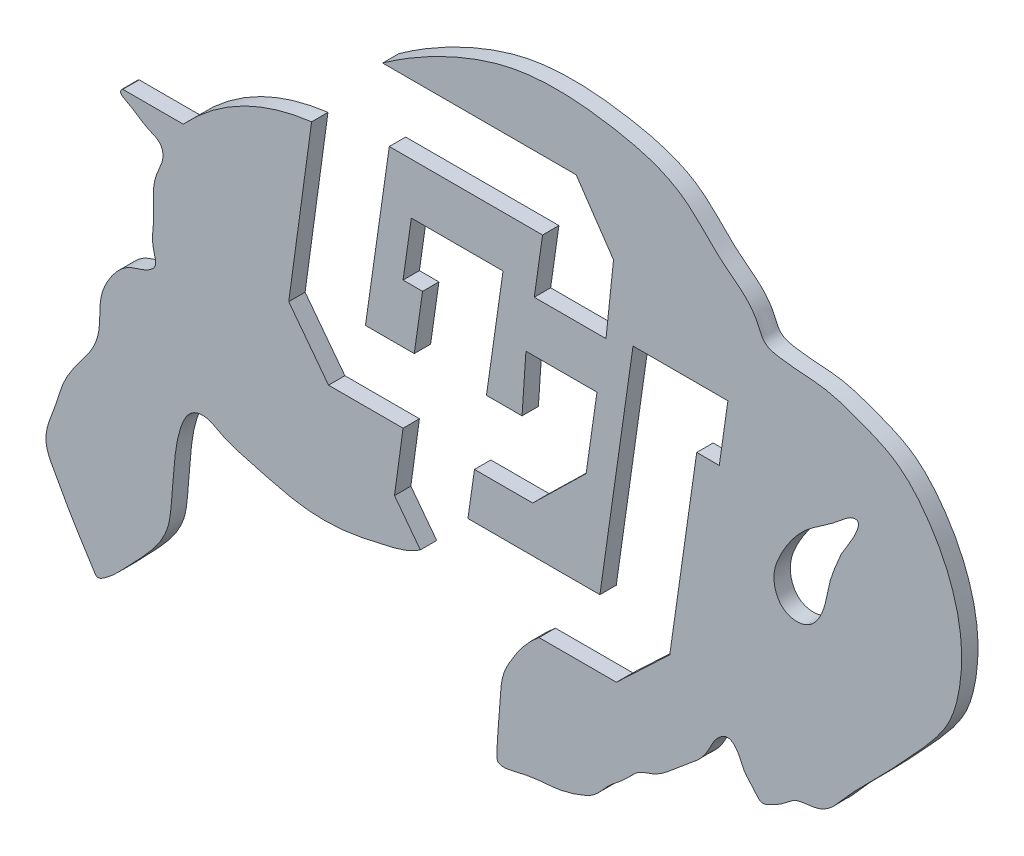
SolidWorks part; units mm, degrees
ref_plane "Front Plane" through (0, 0, 0) normal (0, 0, 1) x (1, 0, 0)
ref_plane "Top Plane" through (0, 0, 0) normal (0, 1, 0) x (1, 0, 0)
ref_plane "Right Plane" through (0, 0, 0) normal (1, 0, 0) x (0, 0, -1)
sketch "Sketch1" plane through (0, 0, 0) normal (0, 0, 1) x (1, 0, 0)
  line L0 (-34.6272, 39.8486) -> (140.0394, 39.8486) construction
sketch "Sketch2" plane through (0, 0, 0) normal (0, 0, 1) x (1, 0, 0)
  line L0 (-31.548, 27.0409) -> (-35.1224, 0.9367) construction
  line L1 (-35.1224, 0.9367) -> (-29.0428, -7.0721) construction
  line L2 (-29.0428, -7.0721) -> (-17.3586, -7.0721) construction
  line L3 (-17.3586, -7.0721) -> (-18.7082, -16.9287) construction
  line L4 (-18.7082, -16.9287) -> (-14.6259, -22.3064) construction
  line L5 (-19.8556, 29.723) -> (-23.607, 3.4631) construction
  line L6 (-23.607, 3.4631) -> (-15.6713, 3.4631) construction
  line L7 (-15.6713, 3.4631) -> (-14.3323, 12.8359) construction
  line L8 (-14.3323, 12.8359) -> (-17.3586, 12.8359) construction
  line L9 (-17.3586, 12.8359) -> (-16.1265, 21.4607) construction
  line L10 (-16.1265, 21.4607) -> (-2.2528, 21.4607) construction
  line L11 (-2.2528, 21.4607) -> (-4.8247, 3.457) construction
  line L12 (-4.8247, 3.457) -> (1.068, 3.457) construction
  line L13 (1.068, 3.457) -> (1.6717, 12.4589) construction
  line L14 (1.6717, 12.4589) -> (12.3273, 12.4589) construction
  line L15 (12.3273, 12.4589) -> (10.6812, 0.9367) construction
  line L16 (10.6812, 0.9367) -> (2.4844, -7.0721) construction
  line L17 (2.4844, -7.0721) -> (-6.6361, -7.0721) construction
  line L18 (-6.6361, -7.0721) -> (-7.7026, -14.5377) construction
  line L19 (-7.7026, -14.5377) -> (13.14, -14.5377) construction
  line L20 (13.14, -14.5377) -> (18.2826, 21.4607) construction
  line L21 (18.2826, 21.4607) -> (32.6451, 21.4607) construction
  line L22 (32.6451, 21.4607) -> (31.3591, 12.4589) construction
  line L23 (31.3591, 12.4589) -> (27.8591, 12.4589) construction
  line L24 (27.8591, 12.4589) -> (23.6609, -16.9287) construction
  line L25 (23.6609, -16.9287) -> (15.4789, -24.6644) construction
  line L26 (15.4789, -24.6644) -> (3.4788, -24.6644) construction
  line L27 (-51.7651, 16.7311) -> (-61.0758, 16.7311) construction
  line L28 (-19.8556, 29.723) -> (4.2918, 29.723) construction
  line L29 (4.2918, 29.723) -> (3.0042, 20.7097) construction
  line L30 (3.0042, 20.7097) -> (13.7738, 20.7097) construction
  line L31 (13.7738, 20.7097) -> (14.9162, 31.6686) construction
  line L32 (14.9162, 31.6686) -> (9.2041, 40.0653) construction
  line L33 (9.2041, 40.0653) -> (-21.2981, 40.0653) construction
  line L34 (-51.6877, 16.5533) -> (-61.058, 16.5533)
  line L35 (-18.8944, -16.9775) -> (-14.8782, -22.268)
  line L36 (-17.5624, -7.2499) -> (-18.8944, -16.9775)
  line L37 (-29.131, -7.2499) -> (-17.5624, -7.2499)
  line L38 (-35.3086, 0.8878) -> (-29.131, -7.2499)
  line L39 (-31.7554, 26.8365) -> (-35.3086, 0.8878)
  line L40 (-6.4818, -7.2499) -> (-7.4976, -14.3599)
  line L41 (-7.4976, -14.3599) -> (12.9858, -14.3599)
  line L42 (12.9858, -14.3599) -> (18.1284, 21.6385)
  line L43 (18.1284, 21.6385) -> (32.8501, 21.6385)
  line L44 (32.8501, 21.6385) -> (31.5133, 12.2811)
  line L45 (31.5133, 12.2811) -> (28.0133, 12.2811)
  line L46 (28.0133, 12.2811) -> (23.8281, -17.0152)
  line L47 (23.8281, -17.0152) -> (15.5497, -24.8422)
  line L48 (15.5497, -24.8422) -> (3.5399, -24.8422)
  line L49 (9.2982, 40.2431) -> (-20.744, 40.2431)
  line L50 (15.0998, 31.7149) -> (9.2982, 40.2431)
  line L51 (13.934, 20.5319) -> (15.0998, 31.7149)
  line L52 (2.7992, 20.5319) -> (13.934, 20.5319)
  line L53 (4.0868, 29.5452) -> (2.7992, 20.5319)
  line L54 (-19.7014, 29.5452) -> (4.0868, 29.5452)
  line L55 (-19.7014, 29.5452) -> (-23.402, 3.6409)
  line L56 (-23.402, 3.6409) -> (-15.8255, 3.6409)
  line L57 (-15.8255, 3.6409) -> (-14.5373, 12.6581)
  line L58 (-14.5373, 12.6581) -> (-17.5636, 12.6581)
  line L59 (-17.5636, 12.6581) -> (-16.2807, 21.6385)
  line L60 (-16.2807, 21.6385) -> (-2.0478, 21.6385)
  line L61 (-2.0478, 21.6385) -> (-4.6197, 3.6348)
  line L62 (-4.6197, 3.6348) -> (0.9017, 3.6348)
  line L63 (0.9017, 3.6348) -> (1.5054, 12.6367)
  line L64 (1.5054, 12.6367) -> (12.5323, 12.6367)
  line L65 (12.5323, 12.6367) -> (10.8487, 0.8517)
  line L66 (10.8487, 0.8517) -> (2.5568, -7.2499)
  line L67 (2.5568, -7.2499) -> (-6.4818, -7.2499)
  point P29 (-41.4742, 24.2867)
  point P32 (-61.5223, 16.3275)
  point P34 (-61.5824, 16.0316)
  point P36 (-60.3643, 14.9585)
  point P38 (-57.084, 12.9856)
  point P40 (-55.325, 11.9159)
  point P42 (-55.016, 10.9414)
  point P43 (-16.7425, 43.0928)
  point P44 (-55.8174, 8.2078)
  point P46 (-56.4205, 6.036)
  point P47 (52.7796, 15.4438)
  point P48 (-56.4205, 2.0899)
  point P49 (-7.7819, 47.5908)
  point P50 (-56.4205, -2.8691)
  point P51 (49.9124, 13.7269)
  point P52 (-56.2127, -4.6429)
  point P53 (0, 49.8856)
  point P54 (-56.9386, -5.4226)
  point P56 (-60.1917, -6.7668)
  point P57 (14.9162, 49.6103)
  point P58 (-62.9071, -9.2941)
  point P59 (44.8904, 10.0119)
  point P60 (-64.6164, -13.0994)
  point P61 (26.2169, 45.4974)
  point P62 (-65.0024, -17.9621)
  point P64 (-65.5427, -19.7373)
  point P65 (32.0671, 40.0653)
  point P66 (-68.2441, -23.8282)
  point P67 (41.3724, 5.3248)
  point P68 (-70.5167, -27.6357)
  point P69 (35.9225, 36.8507)
  point P70 (-71.4687, -30.4918)
  point P71 (-29.9096, 36.0981)
  point P72 (-72.5568, -33.3932)
  point P73 (37.7996, 34.0836)
  point P74 (-73.1461, -36.8387)
  point P75 (-24.9566, 42.1612)
  point P76 (-71.4687, -40.8735)
  point P77 (38.6652, 32.4965)
  point P78 (-69.1173, -45.057)
  point P80 (-67.2326, -48.0504)
  point P81 (40.7332, 31.6686)
  point P82 (-66.1517, -49.8242)
  point P83 (-16.1265, 48.4805)
  point P84 (-65.9299, -50.24)
  point P85 (47.9953, 30.9094)
  point P86 (-65.0707, -51.1546)
  point P87 (40.191, 1.1585)
  point P88 (-63.7958, -50.6834)
  point P89 (53.5259, 29.2262)
  point P90 (-60.4698, -47.6069)
  point P91 (-4.8247, 52.4941)
  point P92 (-56.9221, -43.8375)
  point P93 (59.5856, 26.1892)
  point P94 (-53.901, -38.8208)
  point P96 (-53.358, -35.4564)
  point P97 (63.1445, 22.5413)
  point P98 (-52.7927, -28.834)
  point P99 (4.2918, 54.5187)
  point P100 (-51.7651, -24.0692)
  point P101 (67.444, 14.9585)
  point P102 (-49.966, -21.5656)
  point P103 (41.677, -1.9316)
  point P104 (-48.6739, -21.2425)
  point P105 (69.277, 6.6978)
  point P106 (-45.8473, -22.3064)
  point P107 (16.4117, 53.7752)
  point P108 (-41.4742, -23.8269)
  point P109 (68.962, 0.9367)
  point P110 (-38.2557, -24.6644)
  point P112 (-33.9754, -25.6036)
  point P113 (67.2375, -4.6429)
  point P114 (-27.6761, -25.8459)
  point P115 (30.6738, 47.5908)
  point P116 (-20.8114, -24.6644)
  point P117 (64.9234, -8.0504)
  point P118 (-16.6119, -23.4231)
  point P119 (44.8904, -2.2441)
  point P120 (60.439, -13.0994)
  point P121 (35.2925, 43.6984)
  point P122 (56.8131, -16.9287)
  point P124 (51.0242, -22.9272)
  point P125 (39.054, 39.605)
  point P126 (49.0531, -25.081)
  point P127 (47.2582, 0.4293)
  point P128 (47.2582, -26.2042)
  point P129 (40.7332, 36.4172)
  point P130 (44.8904, -26.6693)
  point P132 (43.326, -27.0498)
  point P133 (41.3724, 35.7289)
  point P134 (41.677, -28.2337)
  point P135 (48.732, 6.036)
  point P136 (39.6898, -29.4176)
  point P137 (45.5383, 35.2942)
  point P138 (37.9562, -29.8827)
  point P140 (36.8569, -28.834)
  point P141 (52.747, 34.0836)
  point P142 (35.2925, -27.0075)
  point P143 (49.9472, 9.1092)
  point P144 (34.0663, -24.6644)
  point P145 (58.2532, 31.6686)
  point P146 (32.9247, -23.8269)
  point P147 (52.8173, 15.6176)
  point P148 (31.3591, -24.6644)
  point P149 (66.555, 24.2867)
  point P150 (29.5422, -27.6357)
  point P151 (50.8915, 10.9414)
  point P152 (28.5698, -28.834)
  point P153 (72.2365, 14.3492)
  point P154 (25.5678, -31.3625)
  point P156 (23.6609, -32.9849)
  point P157 (73.1851, 0.9367)
  point P158 (21.4333, -34.4215)
  point P159 (52.747, 14.3492)
  point P160 (18.9897, -35.4564)
  point P161 (70.3435, -8.0504)
  point P162 (17.1822, -37.1712)
  point P164 (14.345, -39.6271)
  point P165 (67.2375, -12.2823)
  point P166 (12.3273, -41.7247)
  point P168 (9.7838, -43.0454)
  point P169 (57.7326, -22.9272)
  point P170 (6.9995, -43.8375)
  point P172 (1.068, -44.6145)
  point P173 (54.3787, -26.2042)
  point P174 (-3.104, -44.5876)
  point P176 (-3.1847, -43.592)
  point P177 (51.0242, -28.834)
  point P178 (-3.0735, -41.4916)
  point P180 (-2.7239, -36.8387)
  point P181 (46.8565, -29.8827)
  point P182 (-2.0758, -32.2469)
  point P184 (-1.0147, -30.0716)
  point P185 (44.8904, -29.8827)
  point P186 (1.3698, -26.6772)
  point P188 (42.1341, -32.2469)
  point P190 (39.6898, -33.8164)
  point P192 (34.9206, -32.9849)
  point P194 (32.9247, -29.8827)
  point P196 (32.0671, -29.8827)
  point P198 (29.5422, -32.9849)
  point P200 (27.0325, -35.4564)
  point P202 (24.436, -37.453)
  point P204 (20.3228, -39.405)
  point P206 (18.2826, -41.1827)
  point P208 (15.4789, -44.1804)
  point P210 (12.3273, -46.4113)
  point P212 (6.2406, -47.6069)
  point P214 (1.6717, -48.0504)
  point P216 (-4.2514, -48.921)
  point P218 (-7.7026, -46.3705)
  point P220 (-7.7026, -44.5876)
  point P222 (-7.405, -40.5391)
  point P224 (-7.1049, -37.5376)
  point P226 (-6.112, -31.3625)
  point P228 (-4.0245, -26.6772)
  point P230 (-3.0735, -25.6036)
  point P232 (-2.7239, -25.081)
  point P234 (-3.8137, -25.081)
  point P236 (-7.0016, -25.081)
  point P238 (-10.3837, -24.6644)
  point P240 (-11.7143, -25.081)
  point P242 (-15.4844, -27.0075)
  point P244 (-19.0655, -28.2337)
  point P246 (-25.705, -29.4176)
  point P248 (-33.9754, -30.0716)
  point P250 (-40.6143, -28.6428)
  point P252 (-46.6485, -25.8459)
  point P254 (-48.2048, -25.6036)
  point P256 (-48.6739, -26.2042)
  point P258 (-49.0785, -30.3083)
  point P260 (-49.193, -33.9843)
  point P262 (-50.1873, -40.0165)
  point P264 (-51.7651, -44.2882)
  point P266 (-54.59, -47.3247)
  point P268 (-56.9221, -50.24)
  point P270 (-60.4698, -53.8796)
  point P272 (-65.0707, -55.6995)
  point P274 (-69.1173, -52.8396)
  point P276 (-74.0535, -45.057)
  point P278 (-76.74, -38.0201)
  point P280 (-75.9601, -31.3625)
  point P282 (-72.5568, -23.8282)
  point P284 (-70.5167, -20.4746)
  point P286 (-68.8439, -16.4017)
  point P288 (-67.9617, -10.6004)
  point P290 (-65.5427, -6.1756)
  point P292 (-62.0025, -3.4406)
  point P294 (-60.4698, -2.6589)
  point P296 (-60.1917, -1.2514)
  point P298 (-60.2526, 1.6091)
  point P300 (-60.1917, 6.8591)
  point P302 (-59.9958, 8.2078)
  point P304 (-60.1917, 9.5765)
  point P306 (-61.8074, 11.1143)
  point P308 (-64.6164, 13.305)
  point P310 (-65.5427, 15.6759)
  point P312 (-65.0024, 17.8729)
  point P314 (-63.4593, 20.2045)
  point P316 (-61.0758, 20.7097)
  point P318 (-57.084, 20.7097)
  point P320 (-54.3572, 20.7097)
  point P322 (-53.358, 20.7097)
  point P324 (-51.0087, 23.2756)
  point P326 (-48.2144, 24.6883)
  point P328 (-44.5123, 27.0409)
  point P330 (-41.4742, 28.2398)
  point P332 (-38.2557, 29.2262)
  point P334 (-35.3047, 29.4495)
  point P336 (-33.8573, 29.8938)
  point P338 (-32.7483, 31.6686)
  point P340 (-31.548, 33.529)
  point P342 (-30.4229, 35.3984)
  dimension "D1" = 0.1778
  dimension "D2" = 0.1778
extrude "Boss-Extrude1" add sketch "Sketch2" along normal blind 2.54
